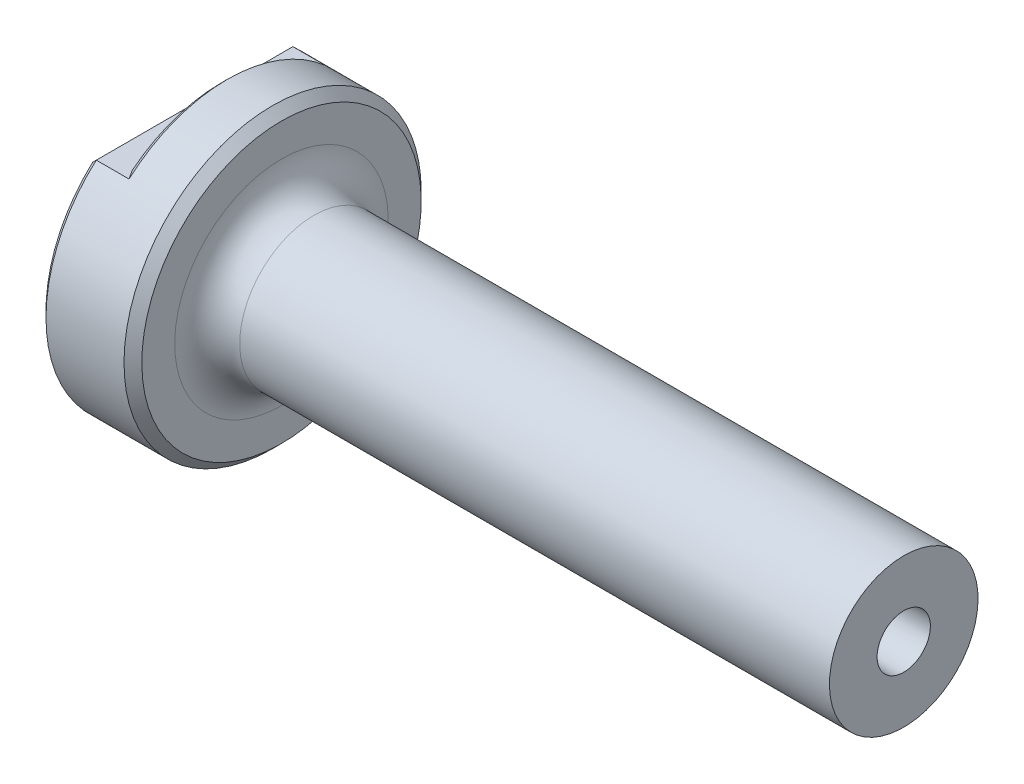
SolidWorks part; units mm, degrees
ref_plane "Front Plane" through (0, 0, 0) normal (0, 0, 1) x (1, 0, 0)
ref_plane "Top Plane" through (0, 0, 0) normal (0, 1, 0) x (1, 0, 0)
ref_plane "Right Plane" through (0, 0, 0) normal (1, 0, 0) x (0, 0, -1)
sketch "Sketch1" plane through (0, 0, 0) normal (1, 0, 0) x (0, 0, -1)
  circle A0 centre (0, 0) radius 25.4
  dimension "Rod Dia" = 50.8
extrude "Boss-Extrude1" add sketch "Sketch1" along normal mid plane 122.2375 contours A0
sketch "Sketch3" plane through (-61.1187, 0, 0) normal (-1, 0, 0) x (0, 0, 1)
  line L1 (-25.4, 25.4) -> (25.4, 25.4)
  line L2 (-25.4, 25.4) -> (-25.4, 19.05)
  line L3 (-25.4, 19.05) -> (25.4, 19.05)
  line L4 (25.4, 25.4) -> (25.4, 19.05)
  line L5 (-25.4, 25.4) -> (25.4, 19.05) construction
  line L6 (-25.4, 19.05) -> (25.4, 25.4) construction
  circle A0 centre (0, 0) radius 25.4 construction
  point P0 (0, 22.225)
  dimension "D1" = 19.05
extrude "Cut-Extrude1" cut sketch "Sketch3" against normal blind 5.588
sketch "Sketch5" plane through (0, 0, 0) normal (0, 0, 1) x (1, 0, 0)
  line L0 (61.1187, 0) -> (-61.1187, 0) construction
  line L1 (61.1187, -25.4) -> (61.1187, 25.4) construction
  line L2 (-61.1187, 19.05) -> (-61.1187, -25.4) construction
  line L3 (-45.2437, -12.7) -> (61.1187, -12.7)
  line L4 (61.1187, -12.7) -> (61.1187, -25.4)
  line L5 (61.1187, -25.4) -> (-45.2437, -25.4)
  line L6 (-61.1187, -25.4) -> (61.1187, -25.4) construction
  line L7 (-45.2437, -25.4) -> (-45.2437, -12.7)
  dimension "B" = 15.875
  dimension "D" = 25.4
revolve "Cut-Revolve1" cut sketch "Sketch5" angle 360 about L0
sketch "Sketch6" plane through (0, 0, 0) normal (0, 0, 1) x (1, 0, 0)
  line L0 (61.1187, 0) -> (-61.1187, 0) construction
  line L1 (61.1187, -12.7) -> (61.1187, 12.7) construction
  line L2 (-61.1187, 19.05) -> (-61.1187, -25.4) construction
  line L3 (-56.4959, 0) -> (-61.1187, 0)
  line L5 (-61.1188, 9.8005) -> (-61.1187, 0)
  arc A0 (-61.1188, 9.8005) -> (-56.4959, 0) centre (-69.1959, 0) cw
  dimension "D1" = 12.7
  dimension "D2" = 4.6228
revolve "Cut-Revolve2" cut sketch "Sketch6" angle 360 about L0
sketch "Sketch7" plane through (0, 0, 0) normal (0, 0, 1) x (1, 0, 0)
  line L0 (-56.6519, 1.9844) -> (61.1188, 4.5541)
  line L2 (61.1187, -12.7) -> (61.1187, 12.7) construction
  line L3 (-56.6519, 0) -> (61.1187, 0)
  line L4 (61.1187, 0) -> (-61.1187, 0) construction
  line L5 (-61.1187, 19.05) -> (-61.1187, -25.4) construction
  line L6 (61.1188, 4.5541) -> (61.1187, 0)
  line L7 (-56.6519, 1.9844) -> (-56.6519, 0)
  line L8 (61.1187, 0) -> (41.1743, 0.1051)
  arc A1 (-61.1188, -9.8005) -> (-61.1188, 9.8005) centre (-69.1959, 0) ccw construction
  dimension "D1" = 1.25
  dimension "D2" = 3.9688
revolve "Cut-Revolve3" cut sketch "Sketch7" angle 360 about L4
fillet "Fillet1" radius 5.5562 1 edges at (-45.2437, 12.7, 0)
chamfer "Chamfer1" distance 1.524 angle 45 1 edges at (-45.2437, 25.4, 0)
chamfer "Chamfer2" distance 1.016 angle 45 3 edges at (-55.5307, 25.4, 0) (-61.1187, -25.4, 0) (-61.1187, 19.05, 0)
